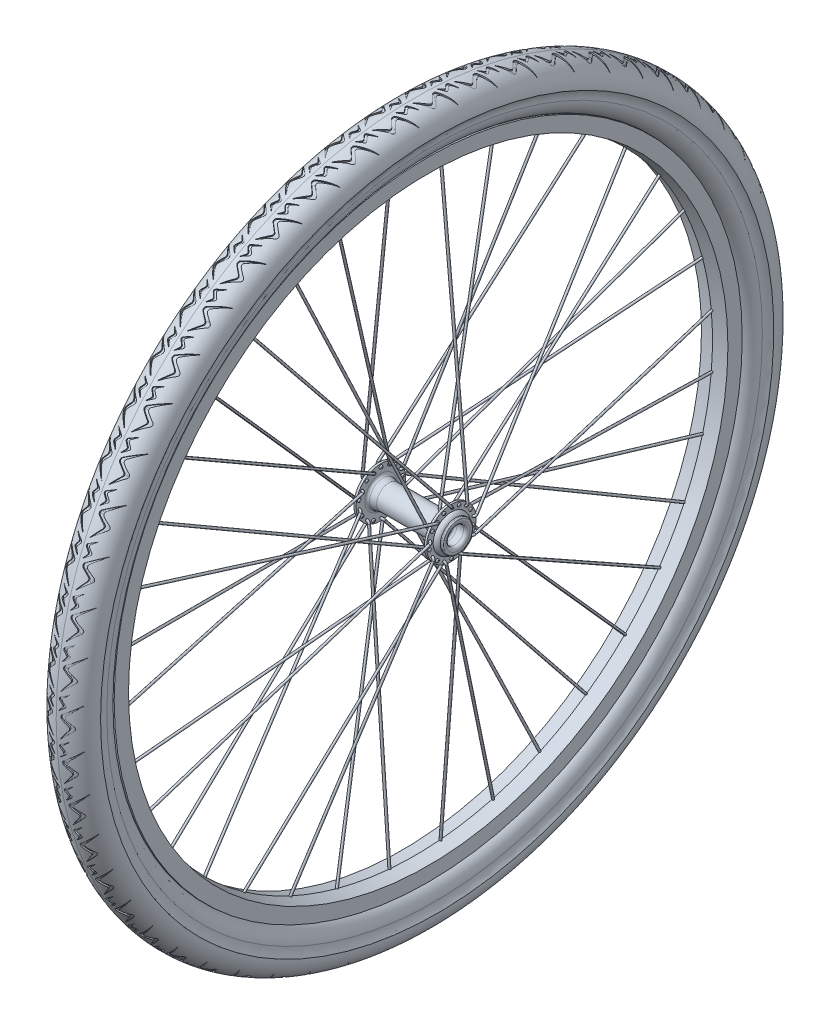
SolidWorks part; units mm, degrees
ref_plane "Front Plane" through (0, 0, 0) normal (0, 0, 1) x (1, 0, 0)
ref_plane "Top Plane" through (0, 0, 0) normal (0, 1, 0) x (1, 0, 0)
ref_plane "Right Plane" through (0, 0, 0) normal (1, 0, 0) x (0, 0, -1)
sketch "Sketch1" plane through (0, 0, 0) normal (0, 0, 1) x (1, 0, 0)
  line L0 (0, 0) -> (-31.3831, 0) construction
  line L1 (0, 0) -> (0, 22.3247) construction
  line L2 (0, 9) -> (-24, 9)
  line L3 (-24, 9) -> (-31.0423, 10.565)
  line L4 (-33, 13.0054) -> (-33, 14.4757)
  line L5 (0, 11) -> (-23.7805, 11)
  line L6 (-23.7805, 11) -> (-29.0423, 12.1693)
  line L7 (-31, 14.6098) -> (-31, 22.5)
  line L8 (-33, 22.5) -> (-31, 22.5)
  line L9 (-37, 13.5) -> (-34.6696, 13.5)
  line L10 (-33, 16.5) -> (-33, 22.5)
  line L11 (-33, 11) -> (-33, 22.5) construction
  line L12 (-24, 9) -> (-33, 11) construction
  line L13 (-23.7805, 11) -> (-31, 12.6043) construction
  line L14 (-31, 12.6043) -> (-31, 22.5) construction
  line L15 (0, 9) -> (24, 9)
  line L16 (0, 11) -> (23.7805, 11)
  line L17 (33, 16.5) -> (33, 22.5)
  line L18 (37, 13.5) -> (34.6696, 13.5)
  line L19 (33, 22.5) -> (31, 22.5)
  line L20 (31, 14.6098) -> (31, 22.5)
  line L21 (23.7805, 11) -> (29.0423, 12.1693)
  line L22 (33, 13.0054) -> (33, 14.4757)
  line L23 (24, 9) -> (31.0423, 10.565)
  arc A0 (-33, 16.5) -> (-37, 13.5) centre (-32.4019, 11.5359) ccw
  arc A1 (-33, 14.4757) -> (-34.6696, 13.5) centre (-32.4019, 11.5359) ccw
  arc A2 (-32.7608, 14.5144) -> (-35.1608, 12.7144) centre (-32.4019, 11.5359) ccw construction
  arc A3 (-31.0423, 10.565) -> (-33, 13.0054) centre (-30.5, 13.0054) cw
  arc A4 (-29.0423, 12.1693) -> (-31, 14.6098) centre (-28.5, 14.6098) cw
  arc A5 (29.0423, 12.1693) -> (31, 14.6098) centre (28.5, 14.6098) ccw
  arc A6 (31.0423, 10.565) -> (33, 13.0054) centre (30.5, 13.0054) ccw
  arc A7 (33, 14.4757) -> (34.6696, 13.5) centre (32.4019, 11.5359) cw
  arc A8 (33, 16.5) -> (37, 13.5) centre (32.4019, 11.5359) cw
  dimension "D9" = 5
  dimension "D12" = 2.5
  dimension "D1" = 9
  dimension "D2" = 5.2619
  dimension "D3" = 7.0423
  dimension "D4" = 22.5
  dimension "D5" = 33
  dimension "D7" = 4
  dimension "D8" = 3
  dimension "D10" = 13.5
  dimension "D6" = 2
  dimension "D11" = 2
revolve "Revolve1" add sketch "Sketch1" angle 360 about L0
sketch "Sketch2" plane through (0, 0, 0) normal (0, 0, 1) x (1, 0, 0)
  line L0 (-37, 0) -> (37, 0) construction
  line L1 (-37, 13.5) -> (-37, -13.5) construction
  line L2 (37, 13.5) -> (37, -13.5) construction
  line L3 (-37, 14) -> (-37, 11)
  line L4 (-36, 10) -> (-30, 10)
  line L5 (-26, 6) -> (-26, 5.5)
  line L6 (-39, 13) -> (-39, 11)
  line L7 (-36, 8) -> (-30, 8)
  line L8 (-28, 6) -> (-28, 5.5)
  line L9 (-38, 14) -> (-37, 14)
  line L10 (-28, 5.5) -> (-26, 5.5)
  line L11 (-39, 14) -> (-39, 11) construction
  line L12 (0, 0) -> (0, 29.255) construction
  line L13 (28, 5.5) -> (26, 5.5)
  line L14 (38, 14) -> (37, 14)
  line L15 (28, 6) -> (28, 5.5)
  line L16 (36, 8) -> (30, 8)
  line L17 (39, 13) -> (39, 11)
  line L18 (26, 6) -> (26, 5.5)
  line L19 (36, 10) -> (30, 10)
  line L20 (37, 14) -> (37, 11)
  arc A0 (-36, 10) -> (-37, 11) centre (-36, 11) cw
  arc A1 (-26, 6) -> (-30, 10) centre (-30, 6) ccw
  arc A2 (-36, 8) -> (-39, 11) centre (-36, 11) cw
  arc A3 (-28, 6) -> (-30, 8) centre (-30, 6) ccw
  arc A4 (-38, 14) -> (-39, 13) centre (-38, 13) ccw
  arc A5 (38, 14) -> (39, 13) centre (38, 13) cw
  arc A6 (28, 6) -> (30, 8) centre (30, 6) cw
  arc A7 (36, 8) -> (39, 11) centre (36, 11) ccw
  arc A8 (26, 6) -> (30, 10) centre (30, 6) cw
  arc A9 (36, 10) -> (37, 11) centre (36, 11) ccw
  point P12 (-37, 10)
  point P15 (-26, 10)
  point P44 (26, 10)
  point P47 (37, 10)
  dimension "D5" = 1
  dimension "D6" = 4
  dimension "D8" = 1
  dimension "D1" = 5.5
  dimension "D2" = 4.5
  dimension "D3" = 11
  dimension "D4" = 4
  dimension "D7" = 2
revolve "Revolve2" add sketch "Sketch2" angle 360 about L0
sketch "Sketch3" plane through (0, 0, 0) normal (1, 0, 0) x (0, 0, -1)
  line L0 (0, 0) -> (0, 22.5) construction
  circle A0 centre (0, 0) radius 22.5 construction
  circle A1 centre (0, 20) radius 1
  dimension "D1" = 2
  dimension "D2" = 20
extrude "Cut-Extrude1" cut sketch "Sketch3" along normal through all and the other way through all
pattern_circular "CirPattern1" count 18 over 360 of "Cut-Extrude1"
sketch "Sketch4" plane through (0, 0, 0) normal (0, 0, 1) x (1, 0, 0)
  line L0 (-39, 0) -> (39, 0) construction
  line L1 (-39, 13) -> (-39, -13) construction
  line L2 (39, -13) -> (39, 13) construction
  line L3 (0, 0) -> (0, 285) construction
  line L4 (-12, 285) -> (-12, 272)
  line L5 (-12, 272) -> (0, 270)
  line L6 (0, 270) -> (12, 272)
  line L7 (12, 272) -> (12, 285)
  line L8 (-10, 284.5) -> (-10, 275.3885)
  line L9 (-8.3288, 273.4157) -> (-0.3288, 272.0824)
  line L10 (0.3288, 272.0824) -> (8.3288, 273.4157)
  line L11 (10, 275.3885) -> (10, 284.5)
  line L12 (-12, 285) -> (-10.5, 285)
  line L13 (10.5, 285) -> (12, 285)
  line L14 (-10, 273.6943) -> (0, 272.0276) construction
  line L15 (0, 272.0276) -> (10, 273.6943) construction
  line L16 (10, 273.6943) -> (10, 285) construction
  line L17 (-10, 285) -> (-10, 273.6943) construction
  arc A0 (-0.3288, 272.0824) -> (0.3288, 272.0824) centre (0, 274.0552) ccw
  arc A1 (8.3288, 273.4157) -> (10, 275.3885) centre (8, 275.3885) ccw
  arc A2 (-8.3288, 273.4157) -> (-10, 275.3885) centre (-8, 275.3885) cw
  arc A3 (10, 284.5) -> (10.5, 285) centre (10.5, 284.5) cw
  arc A4 (-10, 284.5) -> (-10.5, 285) centre (-10.5, 284.5) ccw
  dimension "D6" = 2
  dimension "D7" = 0.5
  dimension "D1" = 285
  dimension "D2" = 24
  dimension "D3" = 13
  dimension "D4" = 2
  dimension "D5" = 2
revolve "Revolve3" add sketch "Sketch4" angle 360 about L0
sketch "Sketch5" plane through (0, 0, 0) normal (1, 0, 0) x (0, 0, -1)
  line L0 (0, -273) -> (0, 273) construction
  line L1 (-273, 0) -> (273, 0) construction
  circle A0 centre (0, 0) radius 273
  dimension "D1" = 546
sketch3d "3DSketch4"
  line L0 (30, 3.473, 19.6962) -> (32.7091, 3.473, 19.6962)
  line L1 (33, 3.473, 19.6962) -> (31, 3.473, 19.6962) construction
  line L2 (34.6908, 2.4164, 21.7053) -> (0, -116.1022, 247.0815)
  circle A0 centre (0, 0, 0) radius 273 construction
  circle A1 centre (31, 3.473, 19.6962) radius 1 construction
  arc A2 (34.6908, 2.4164, 21.7053) -> (32.7091, 3.473, 19.6962) centre (32.7091, 2.5421, 21.4663) ccw
  point P7 (273, 0, 0)
  point P12 (32, 3.473, 19.6962)
  point P15 (35, 3.473, 19.6962)
  point P16 (32.7091, 4.3123, 22.3972)
  dimension "D3" = 2
  dimension "D1" = 1
  dimension "D2" = 5
  dimension "D4" = 118.96
ref_plane "Plane1" through (0, -116.1022, 247.0815) normal (-0.135, -0.4612, 0.877) x (0.9908, -0.0628, 0.1195)
sketch "Sketch6" plane through (0, -116.1022, 247.0815) normal (-0.135, -0.4612, 0.877) x (0.9908, -0.0628, 0.1195)
  circle A0 centre (0, 0) radius 1
  dimension "D1" = 2
sweep "Sweep1" add profiles "Sketch6" path "3DSketch4"
sketch "Sketch7" plane through (-36.4777, -124.6236, 236.9856) normal (-0.135, -0.4612, 0.877) x (0.9908, -0.0628, 0.1195)
  circle A0 centre (36.8147, 12.2412) radius 1.5
  dimension "D1" = 3
extrude "Boss-Extrude1" add sketch "Sketch7" against normal blind 1
fillet "Fillet1" radius 1 1 edges at (0, -117.4298, 246.3834)
sketch "Sketch8" plane through (30, 0, 0) normal (-1, 0, 0) x (0, 0, 1)
  circle A0 centre (19.6962, 3.473) radius 1.5
  dimension "D1" = 3
extrude "Boss-Extrude2" add sketch "Sketch8" against normal blind 1
fillet "Fillet2" radius 1 1 edges at (30, 1.973, 19.6962)
pattern_circular "CirPattern2" count 9 over 360 of "Sweep1", "Boss-Extrude1", "Fillet1", "Boss-Extrude2", "Fillet2"
sketch3d "3DSketch5"
  line L0 (34, -3.473, 19.6962) -> (30.7869, -3.473, 19.6962)
  line L1 (33, -3.473, 19.6962) -> (31, -3.473, 19.6962) construction
  line L2 (28.7996, -2.6465, 21.2678) -> (0, 116.1022, 247.0815)
  circle A0 centre (0, 0, 0) radius 273 construction
  circle A1 centre (33, -3.473, 19.6962) radius 1 construction
  arc A3 (28.7996, -2.6465, 21.2678) -> (30.7869, -3.473, 19.6962) centre (30.7869, -2.5421, 21.4663) ccw
  point P9 (273, 0, 0)
  point P10 (32, -3.473, 19.6962)
  point P15 (29, -3.473, 19.6962)
  point P17 (30.7869, -4.3123, 22.3972)
  dimension "D4" = 2
  dimension "D1" = 1
  dimension "D2" = 5
  dimension "D3" = 118.96
ref_plane "Plane2" through (0, 116.1022, 247.0815) normal (-0.1122, 0.4625, 0.8795) x (0.9937, 0.0522, 0.0993)
sketch "Sketch9" plane through (0, 116.1022, 247.0815) normal (-0.1122, 0.4625, 0.8795) x (0.9937, 0.0522, 0.0993)
  circle A0 centre (0, 0) radius 1
  dimension "D1" = 2
sweep "Sweep2" add profiles "Sketch9" path "3DSketch5"
sketch "Sketch10" plane through (-30.398, 125.3395, 238.347) normal (-0.1122, 0.4625, 0.8795) x (0.9937, 0.0522, 0.0993)
  circle A0 centre (30.5911, -12.2412) radius 1.5
  dimension "D1" = 3
extrude "Boss-Extrude3" add sketch "Sketch10" against normal blind 1
fillet "Fillet3" radius 1 1 edges at (0, 114.7746, 247.7797)
sketch "Sketch11" plane through (34, 0, 0) normal (1, 0, 0) x (0, 0, -1)
  circle A0 centre (-19.6962, -3.473) radius 1.5
  dimension "D1" = 3
extrude "Boss-Extrude4" add sketch "Sketch11" against normal blind 1
fillet "Fillet4" radius 1 1 edges at (34, -1.973, 19.6962)
pattern_circular "CirPattern3" count 9 over 360 of "Sweep2", "Boss-Extrude3", "Fillet3", "Boss-Extrude4", "Fillet4"
sketch3d "3DSketch6"
  line L0 (-30, 3.473, -19.6962) -> (-32.7091, 3.473, -19.6962)
  line L1 (-31, 3.473, -19.6962) -> (-33, 3.473, -19.6962) construction
  line L2 (-34.6908, 2.4164, -21.7053) -> (0, -116.1022, -247.0815)
  circle A0 centre (0, 0, 0) radius 273 construction
  circle A1 centre (-31, 3.473, -19.6962) radius 1 construction
  arc A2 (-34.6908, 2.4164, -21.7053) -> (-32.7091, 3.473, -19.6962) centre (-32.7091, 2.5421, -21.4663) ccw
  point P7 (273, 0, 0)
  point P12 (-32, 3.473, -19.6962)
  point P16 (-35, 3.473, -19.6962)
  point P17 (-32.7091, 4.3123, -22.3972)
  dimension "D4" = 2
  dimension "D1" = 1
  dimension "D2" = 5
  dimension "D3" = 118.96
ref_plane "Plane3" through (0, -116.1022, -247.0815) normal (0.135, -0.4612, -0.877) x (-0.9908, -0.0628, -0.1195)
sketch "Sketch12" plane through (0, -116.1022, -247.0815) normal (0.135, -0.4612, -0.877) x (-0.9908, -0.0628, -0.1195)
  circle A0 centre (0, 0) radius 1
  dimension "D1" = 2
sweep "Sweep3" add profiles "Sketch12" path "3DSketch6"
sketch "Sketch13" plane through (36.4777, -124.6236, -236.9856) normal (0.135, -0.4612, -0.877) x (-0.9908, -0.0628, -0.1195)
  circle A0 centre (36.8147, 12.2412) radius 1.5
  dimension "D1" = 3
extrude "Boss-Extrude5" add sketch "Sketch13" against normal blind 1
fillet "Fillet5" radius 1 1 edges at (0, -114.7746, -247.7797)
sketch "Sketch14" plane through (-30, 0, 0) normal (1, 0, 0) x (0, 0, -1)
  circle A0 centre (19.6962, 3.473) radius 1.5
  dimension "D1" = 3
extrude "Boss-Extrude6" add sketch "Sketch14" against normal blind 1
fillet "Fillet6" radius 1 1 edges at (-30, 3.473, -21.1962)
pattern_circular "CirPattern4" count 9 over 360 of "Sweep3", "Boss-Extrude5", "Fillet5", "Boss-Extrude6", "Fillet6"
sketch3d "3DSketch7"
  line L0 (-34, -3.473, -19.6962) -> (-30.7869, -3.473, -19.6962)
  line L1 (-31, -3.473, -19.6962) -> (-33, -3.473, -19.6962) construction
  line L2 (-28.7996, -2.6465, -21.2678) -> (0, 116.1022, -247.0815)
  circle A0 centre (0, 0, 0) radius 273 construction
  circle A1 centre (-33, -3.473, -19.6962) radius 1 construction
  arc A2 (-28.7996, -2.6465, -21.2678) -> (-30.7869, -3.473, -19.6962) centre (-30.7869, -2.5421, -21.4663) ccw
  point P7 (273, 0, 0)
  point P12 (-32, -3.473, -19.6962)
  point P16 (-29, -3.473, -19.6962)
  point P17 (-30.7869, -4.3123, -22.3972)
  dimension "D4" = 2
  dimension "D1" = 1
  dimension "D2" = 5
  dimension "D3" = 118.96
ref_plane "Plane4" through (0, 116.1022, -247.0815) normal (0.1122, 0.4625, -0.8795) x (-0.9937, 0.0522, -0.0993)
sketch "Sketch15" plane through (0, 116.1022, -247.0815) normal (0.1122, 0.4625, -0.8795) x (-0.9937, 0.0522, -0.0993)
  circle A0 centre (0, 0) radius 1
  dimension "D1" = 2
sweep "Sweep4" add profiles "Sketch15" path "3DSketch7"
sketch "Sketch16" plane through (30.398, 125.3395, -238.347) normal (0.1122, 0.4625, -0.8795) x (-0.9937, 0.0522, -0.0993)
  circle A0 centre (30.5911, -12.2412) radius 1.5
  dimension "D1" = 3
extrude "Boss-Extrude7" add sketch "Sketch16" against normal blind 1
fillet "Fillet7" radius 1 1 edges at (0, 117.4298, -246.3834)
sketch "Sketch17" plane through (-34, 0, 0) normal (-1, 0, 0) x (0, 0, 1)
  circle A0 centre (-19.6962, -3.473) radius 1.5
  dimension "D1" = 3
extrude "Boss-Extrude8" add sketch "Sketch17" against normal blind 1
fillet "Fillet8" radius 1 1 edges at (-34, -3.473, -18.1962)
pattern_circular "CirPattern5" count 9 over 360 of "Sweep4", "Boss-Extrude7", "Fillet7", "Boss-Extrude8", "Fillet8"
sketch "Sketch19" plane through (0, 0, 0) normal (0, 0, 1) x (1, 0, 0)
  line L0 (-39, 0) -> (39, 0) construction
  line L1 (-39, 13) -> (-39, -13) construction
  line L2 (39, -13) -> (39, 13) construction
  line L3 (0, 0) -> (0, 427.4071) construction
  line L4 (-10, 280.9957) -> (-10, 284.4155)
  line L5 (-10, -284.5) -> (-10, 284.5) construction
  line L6 (-8, 280.9957) -> (-8, 284.4155)
  line L7 (-10, 280.9957) -> (-8, 280.9957)
  line L8 (10, 280.9957) -> (10, 284.4155)
  line L9 (10, 280.9957) -> (8, 280.9957)
  line L10 (8, 280.9957) -> (8, 284.4155)
  line L11 (-0.0138, 323.6336) -> (0.0138, 323.6336)
  arc A0 (-10.4878, 285.2744) -> (-17.79, 297.4957) centre (-2.8046, 298.1573) cw
  arc A1 (-17.79, 297.4957) -> (-20.1379, 305.4957) centre (-30.7791, 298.0282) ccw
  arc A2 (-20.1379, 305.4957) -> (0, 325.6336) centre (-0.1379, 305.6336) cw
  arc A3 (-10, 284.4155) -> (-10.4878, 285.2744) centre (-11, 284.4155) ccw
  arc A4 (-8, 284.4155) -> (-9.4634, 286.9921) centre (-11, 284.4155) ccw
  arc A5 (-9.4634, 286.9921) -> (-15.7882, 297.505) centre (-2.8046, 298.1573) cw
  arc A6 (-15.7882, 297.505) -> (-18.1324, 306.0943) centre (-30.7791, 298.0282) ccw
  arc A7 (-18.1324, 306.0943) -> (-0.0138, 323.6336) centre (-0.1379, 305.6336) cw
  arc A8 (10, 284.4155) -> (10.4878, 285.2744) centre (11, 284.4155) cw
  arc A9 (8, 284.4155) -> (9.4634, 286.9921) centre (11, 284.4155) cw
  arc A10 (10.4878, 285.2744) -> (17.79, 297.4957) centre (2.8046, 298.1573) ccw
  arc A11 (18.1324, 306.0943) -> (0.0138, 323.6336) centre (0.1379, 305.6336) ccw
  arc A12 (15.7882, 297.505) -> (18.1324, 306.0943) centre (30.7791, 298.0282) cw
  arc A13 (9.4634, 286.9921) -> (15.7882, 297.505) centre (2.8046, 298.1573) ccw
  arc A14 (20.1379, 305.4957) -> (0, 325.6336) centre (0.1379, 305.6336) ccw
  arc A15 (17.79, 297.4957) -> (20.1379, 305.4957) centre (30.7791, 298.0282) cw
  point P22 (-10, 284.9957)
  dimension "D8" = 15
  dimension "D9" = 13
  dimension "D10" = 1
  dimension "D1" = 7.58
  dimension "D2" = 4
  dimension "D3" = 12.5
  dimension "D4" = 17.79
  dimension "D5" = 8
  dimension "D6" = 20
  dimension "D7" = 20
  dimension "D11" = 2
revolve "Revolve4" add sketch "Sketch19" angle 360 about L0
sketch "Sketch20" plane through (0, 0, 0) normal (0, 0, 1) x (1, 0, 0)
  line L0 (-39, 0) -> (39, 0) construction
  line L1 (-39, 13) -> (-39, -13) construction
  line L2 (39, -13) -> (39, 13) construction
  arc A5 (0, 324.6335) -> (-19.1383, 305.6336) centre (-0.1379, 305.6336) ccw
  arc A6 (19.1383, 305.6336) -> (0, 324.6335) centre (0.1379, 305.6336) ccw
  arc A7 (0, 324.6335) -> (-19.1383, 305.6336) centre (-0.1379, 305.6336) ccw
  arc A8 (19.1383, 305.6336) -> (0, 324.6335) centre (0.1379, 305.6336) ccw
  dimension "D1" = 1
surface "Surface-Revolve1" sketch "Sketch20" parameters "D1"=360
ref_plane "Plane5" through (0, 0, 335) normal (0, 0, 1) x (1, 0, 0)
sketch "Sketch21" plane through (0, 0, 335) normal (0, 0, 1) x (1, 0, 0)
  line L0 (-20.1383, 0) -> (20.1383, 0) construction
  line L1 (-20.1383, 305.6336) -> (-20.1383, -305.6336) construction
  line L2 (20.1383, -305.6336) -> (20.1383, 305.6336) construction
  line L3 (-20.1379, 15) -> (20.1383, 15) construction
  line L4 (-20.1379, 305.4957) -> (-20.1379, -305.4957) construction
  line L5 (-16.5113, 13.9352) -> (-7.8688, 5.7663)
  line L6 (-7.8183, 2.1817) -> (-12.1925, -2.1925)
  line L7 (-12.1528, -5.7669) -> (-3.3061, -14.229)
  line L8 (0, 325.6336) -> (0, -325.6336) construction
  line L9 (-16.3838, 14.0887) -> (-4.8678, 5.7206)
  line L10 (-4.5696, 1.9304) -> (-8.9895, -2.4895)
  line L11 (-9.2435, -5.7277) -> (-3.1561, -14.0979)
  line L12 (-9.0596, 21.7163) -> (-5.1462, 18.4552)
  line L13 (-4.949, 16.3487) -> (-7.1632, 13.6627)
  line L14 (-6.9547, 11.5468) -> (-2.5946, 7.9857)
  line L15 (-8.9448, 21.8793) -> (-3.0147, 18.391)
  line L16 (-2.6178, 16.144) -> (-4.884, 13.3948)
  line L17 (-4.9414, 11.5608) -> (-2.4504, 8.1218)
  arc A0 (-8.9895, -2.4895) -> (-9.2435, -5.7277) centre (-7.2217, -4.2572) ccw
  arc A1 (-12.1925, -2.1925) -> (-12.1528, -5.7669) centre (-10.4247, -3.9603) ccw
  arc A2 (-7.8688, 5.7663) -> (-7.8183, 2.1817) centre (-9.586, 3.9495) cw
  arc A3 (-4.8678, 5.7206) -> (-4.5696, 1.9304) centre (-6.3374, 3.6981) cw
  arc A4 (-3.3061, -14.229) -> (-3.1561, -14.0979) centre (-3.237, -14.1567) ccw
  arc A5 (-16.5113, 13.9352) -> (-16.3838, 14.0887) centre (-16.4426, 14.0078) cw
  arc A6 (-4.884, 13.3948) -> (-4.9414, 11.5608) centre (-3.7266, 12.4407) ccw
  arc A7 (-7.1632, 13.6627) -> (-6.9547, 11.5468) centre (-6.0058, 12.7086) ccw
  arc A8 (-5.1462, 18.4552) -> (-4.949, 16.3487) centre (-6.1065, 17.3028) cw
  arc A9 (-3.0147, 18.391) -> (-2.6178, 16.144) centre (-3.7752, 17.0981) cw
  arc A10 (-2.5946, 7.9857) -> (-2.4504, 8.1218) centre (-2.5314, 8.0631) ccw
  arc A11 (-9.0596, 21.7163) -> (-8.9448, 21.8793) centre (-8.9955, 21.7931) cw
  point P21 (-10.5, -4)
  point P24 (-14, -4)
  point P27 (-6, 4)
  point P30 (-2.5, 4)
  point P33 (-2.5, -15)
  point P36 (-17.6379, 15)
  point P46 (-5.6217, 12.5)
  point P49 (-8.1217, 12.5)
  point P52 (-4, 17.5)
  point P55 (-1.5, 17.5)
  point P58 (-2, 7.5)
  point P61 (-10, 22.5)
  dimension "D12" = 2.5
  dimension "D13" = 0.1
  dimension "D24" = 1.5
  dimension "D25" = 0.1
  dimension "D1" = 15
  dimension "D2" = 45
  dimension "D3" = 4
  dimension "D4" = 6
  dimension "D5" = 8
  dimension "D6" = 11
  dimension "D7" = 11
  dimension "D8" = 2.5
  dimension "D9" = 2.5
  dimension "D10" = 3.5
  dimension "D11" = 3.5
  dimension "D14" = 50.5
  dimension "D15" = 5
  dimension "D16" = 2.5
  dimension "D17" = 5
  dimension "D18" = 5
  dimension "D19" = 10
  dimension "D20" = 2
  dimension "D21" = 4
  dimension "D22" = 2.5
  dimension "D23" = 2.5
extrude "Cut-Extrude2" cut sketch "Sketch21" against normal up to surface (12.5633 mm away)
pattern_circular "CirPattern6" count 55 over 360 of "Cut-Extrude2"
mirror "Mirror1" about plane through (0, 0, 0) normal (1, 0, 0) of "Cut-Extrude2", "CirPattern6"
